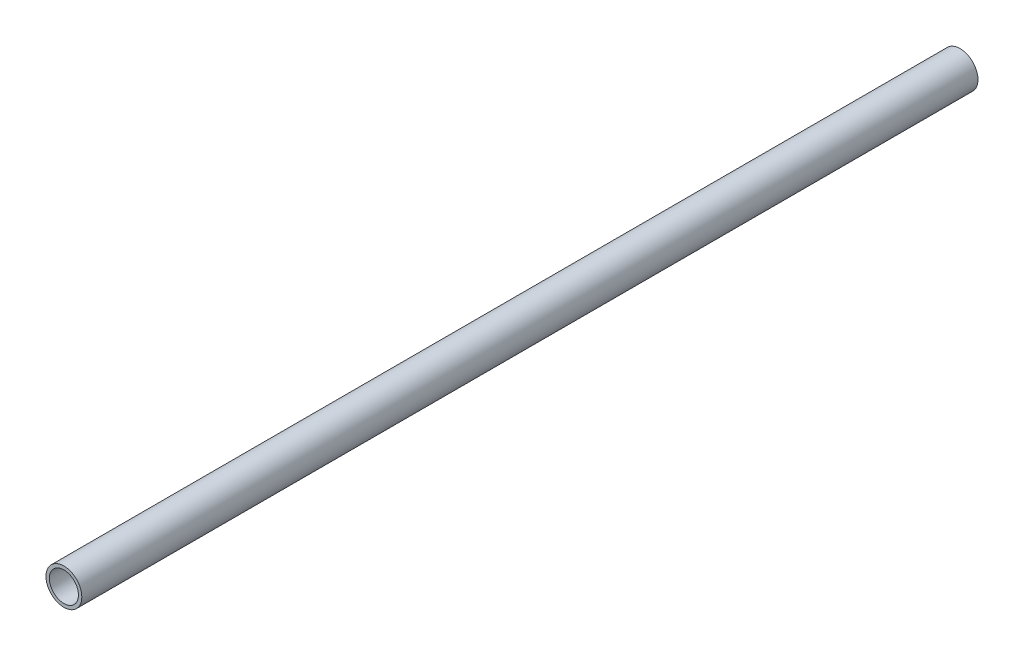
SolidWorks part; units mm, degrees
ref_plane "Alzado" through (0, 0, 0) normal (0, 0, 1) x (1, 0, 0)
ref_plane "Planta" through (0, 0, 0) normal (0, 1, 0) x (1, 0, 0)
ref_plane "Vista lateral" through (0, 0, 0) normal (1, 0, 0) x (0, 0, -1)
sketch "Croquis1" plane through (0, 0, 0) normal (0, 0, 1) x (1, 0, 0)
  circle A0 centre (0, 0) radius 8
  circle A1 centre (0, 0) radius 6.5
  dimension "D1" = 16
  dimension "D2" = 13
extrude "Saliente-Extruir1" add sketch "Croquis1" along normal blind 400
